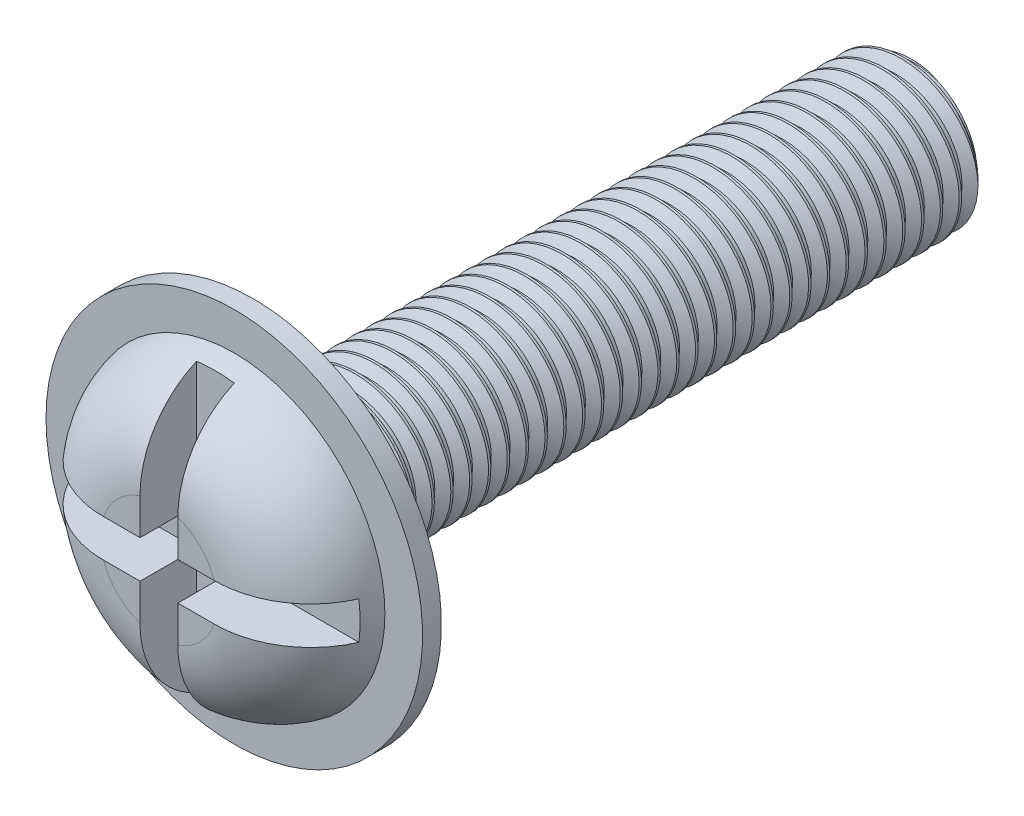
SolidWorks part; units mm, degrees
ref_plane "Плоскость1" through (0, 0, 0) normal (0, 0, 1) x (1, 0, 0)
ref_plane "Плоскость2" through (0, 0, 0) normal (0, 1, 0) x (1, 0, 0)
ref_plane "Плоскость3" through (0, 0, 0) normal (1, 0, 0) x (0, 0, -1)
sketch "Эскиз1" plane through (0, 0, 0) normal (0, 0, 1) x (1, 0, 0)
  circle A0 centre (0, 0) radius 4
  dimension "D1" = 8
extrude "Основание-Вытянуть" add sketch "Эскиз1" along normal blind 36
sketch "Эскиз2" plane through (0, 0, 36) normal (0, 0, 1) x (1, 0, 0)
  circle A0 centre (0, 0) radius 8
  dimension "D1" = 16
extrude "Бобышка-Вытянуть1" add sketch "Эскиз2" along normal blind 4
fillet "Скругление1" radius 5 1 edges at (8, 0, 40)
chamfer "Фаска1" distance 0.5 angle 45 1 edges at (4, 0, 0)
sketch "Эскиз3" plane through (0, 0, 40) normal (0, 0, 1) x (1, 0, 0)
  line L0 (0, 0) -> (0, 44.3713) construction
  line L1 (1.0048, 1) -> (10.0296, 1)
  line L2 (-10.0296, 1) -> (-1.0048, 1)
  line L3 (-10.0296, -1) -> (-1.0048, -1)
  line L4 (10.0296, 1) -> (10.0296, -1)
  line L5 (-10.0296, 1) -> (-10.0296, -1)
  line L6 (-1.0048, 10.0249) -> (1.0048, 10.0249)
  line L7 (-1.0048, 10.0249) -> (-1.0048, 1)
  line L8 (-1.0048, -10.0249) -> (1.0048, -10.0249)
  line L9 (1.0048, 10.0249) -> (1.0048, 1)
  line L10 (1.0048, -1) -> (1.0048, -10.0249)
  line L11 (-1.0048, -1) -> (-1.0048, -10.0249)
  line L12 (1.0048, -1) -> (10.0296, -1)
  line L13 (0, -10.0249) -> (0, 10.0249) construction
  line L14 (10.0296, 0) -> (-10.0296, 0) construction
extrude "Вырез-Вытянуть1" cut sketch "Эскиз3" against normal blind 3
sketch "Эскиз4" plane through (0, 0, 36) normal (0, 0, -1) x (-1, 0, 0)
  circle A0 centre (0, 0) radius 10
  dimension "D1" = 20
extrude "Бобышка-Вытянуть2" add sketch "Эскиз4" along normal blind 1
thread "Резьба1" pitch 1 start angle 0, offset 1, length 35, pitch 1, diameter 8
ref_plane "Плоскость4" through (4, 0, -0.5) normal (0, -1, 0) x (1, 0, 0)
sketch "Профиль резьбы1" plane through (4, 0, -0.5) normal (0, -1, 0) x (1, 0, 0)
  line L0 (0, 0) -> (0, 1) construction
  line L11 (0, 0) -> (0, 0.875)
  line L12 (0, 0.875) -> (-0.5413, 0.5625)
  line L13 (-0.5413, 0.5625) -> (-0.5413, 0.3125)
  line L15 (-0.5413, 0.3125) -> (0, 0)
  line L17 (-0.5413, 0.4375) -> (0, 0.4375) construction
  point P2 (0, 0)
  dimension "Pitch" = 1
  dimension "Profile_Angle" = 60
  dimension "Profile_Land" = 0.25
  dimension "Profile_Height" = 0.5413
